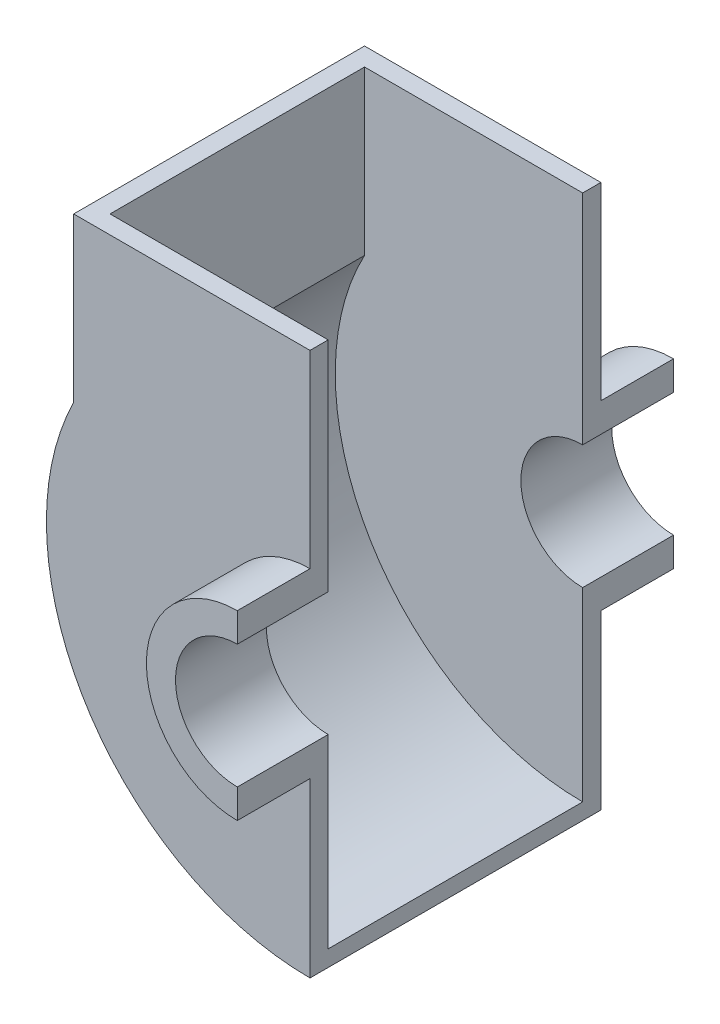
SolidWorks part; units mm, degrees
ref_plane "Front Plane" through (0, 0, 0) normal (0, 0, 1) x (1, 0, 0)
ref_plane "Top Plane" through (0, 0, 0) normal (0, 1, 0) x (1, 0, 0)
ref_plane "Right Plane" through (0, 0, 0) normal (1, 0, 0) x (0, 0, -1)
sketch "Sketch1" plane through (0, 0, 0) normal (0, 0, 1) x (1, 0, 0)
  line L0 (0, 25) -> (0, 17)
  line L1 (0, -17) -> (0, -25)
  arc A0 (0, 17) -> (0, -17) centre (0, 0) ccw
  arc A1 (0, 25) -> (0, -25) centre (0, 0) ccw
  dimension "D1" = 34
  dimension "D2" = 50
extrude "Boss-Extrude1" add sketch "Sketch1" along normal blind 20 and the other way blind 5
sketch "Sketch2" plane through (0, 0, 0) normal (0, 0, 1) x (1, 0, 0)
  line L0 (0, -25) -> (0, -72.5)
  line L1 (0, 25) -> (0, 77)
  line L2 (0, 77) -> (-65, 77)
  line L3 (-65, 77) -> (-65, 32.1131)
  arc A0 (-65, 32.1131) -> (0, -72.5) centre (0, 0) ccw
  arc A1 (0, 25) -> (0, -25) centre (0, 0) ccw
  arc A2 (0, 25) -> (0, -25) centre (0, 0) ccw construction
  dimension "D1" = 145
  dimension "D2" = 52
  dimension "D3" = 65
extrude "Boss-Extrude3" add sketch "Sketch2" against normal blind 5 contours A1 L1 L2 L3 A0 L0
ref_plane "Plane1" through (0, 0, -40) normal (0, 0, 1) x (1, 0, 0)
mirror "Mirror1" about plane through (0, 0, -40) normal (0, 0, 1)
sketch "Sketch4" plane through (0, 0, -5) normal (0, 0, -1) x (-1, 0, 0)
  line L0 (65, 32.1131) -> (65, 77)
  line L1 (65, 77) -> (60, 77)
  line L2 (0, 77) -> (65, 77) construction
  line L3 (60, 77) -> (60, 32.1131)
  line L4 (0, -68.0533) -> (0, -72.5)
  arc A0 (0, -72.5) -> (65, 32.1131) centre (0, 0) ccw
  arc A1 (0, -68.0533) -> (60, 32.1131) centre (0, 0) ccw
  dimension "D1" = 5
extrude "Boss-Extrude4" add sketch "Sketch4" along normal up to surface (70 mm away)
